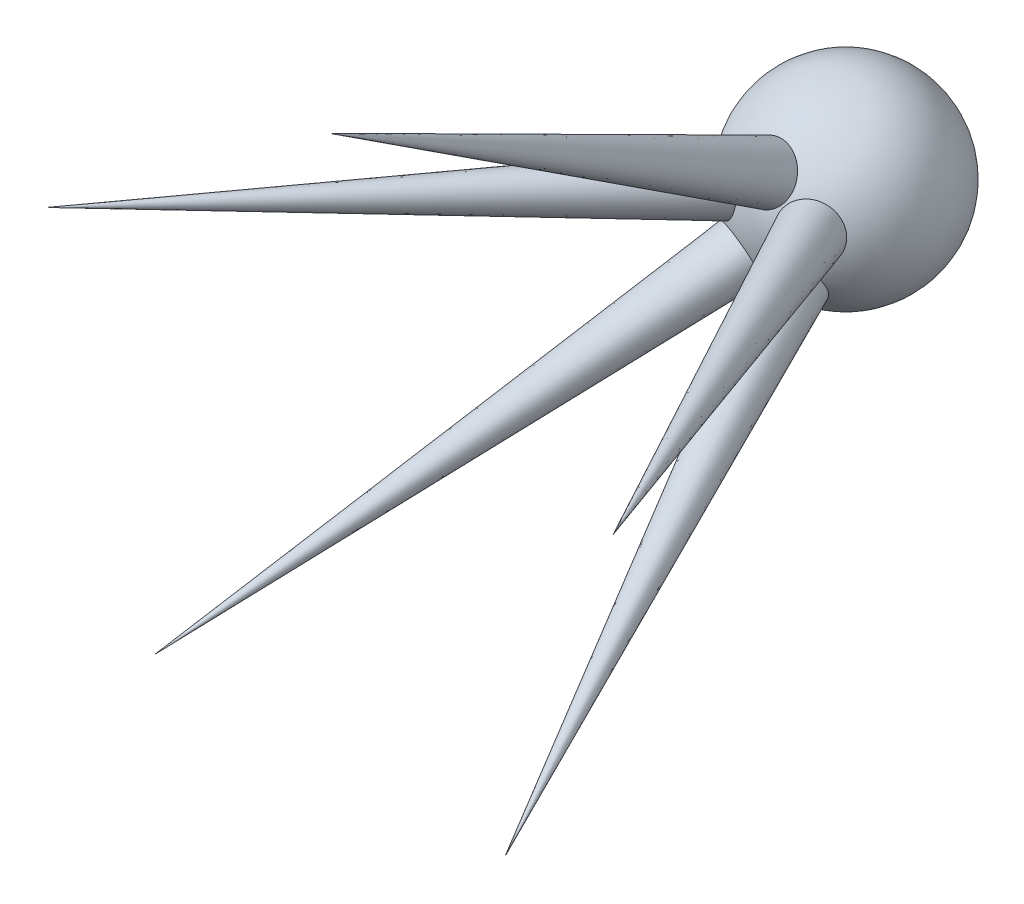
SolidWorks part; units mm, degrees
ref_plane "Front Plane" through (0, 0, 0) normal (0, 0, 1) x (1, 0, 0)
ref_plane "Top Plane" through (0, 0, 0) normal (0, 1, 0) x (1, 0, 0)
ref_plane "Right Plane" through (0, 0, 0) normal (1, 0, 0) x (0, 0, -1)
body saved out of another part "Stock-Cactus test model-1"
sketch "Sketch1" plane through (0, 0, 0) normal (1, 0, 0) x (0, 0, -1)
  point P0 (-38.1117, 28.3667)
